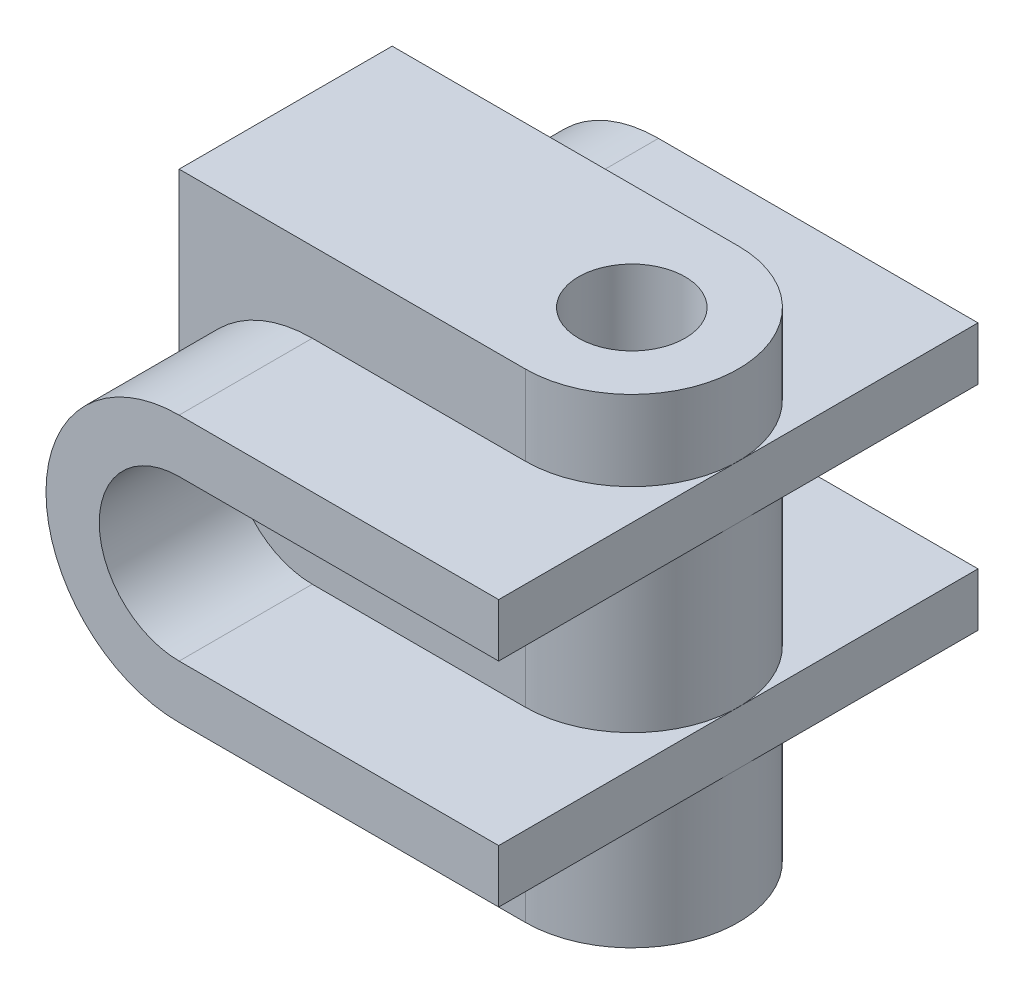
SolidWorks part; units mm, degrees
ref_plane "Front" through (0, 0, 0) normal (0, 0, 1) x (1, 0, 0)
ref_plane "Top" through (0, 0, 0) normal (0, 1, 0) x (1, 0, 0)
ref_plane "Right" through (0, 0, 0) normal (1, 0, 0) x (0, 0, -1)
sketch "Sketch1" plane through (0, 0, 0) normal (0, 0, 1) x (1, 0, 0)
  line L0 (0, -15) -> (-60, -15)
  line L1 (-60, -65) -> (0, -65)
  arc A0 (-60, -15) -> (-60, -65) centre (-60, -40) ccw
  dimension "D3" = 25
  dimension "D1" = 15
  dimension "D2" = 60
extrude "Extrude-Thin1" add sketch "Sketch1" along normal blind 90 thin
sketch "Sketch2" plane through (0, 0, 0) normal (0, 1, 0) x (1, 0, 0)
  line L0 (-85, -25) -> (-85, -65)
  line L1 (-85, 0) -> (-85, -90) construction
  line L2 (-85, -65) -> (-20, -65)
  line L3 (-20, -25) -> (-85, -25)
  line L4 (0, -90) -> (0, 0) construction
  arc A0 (-20, -65) -> (-20, -25) centre (-20, -45) ccw
  circle A1 centre (-20, -45) radius 10
  dimension "D2" = 25
  dimension "D3" = 20
  dimension "D1" = 40
extrude "Extrude1" add sketch "Sketch2" against normal blind 90 separate body
